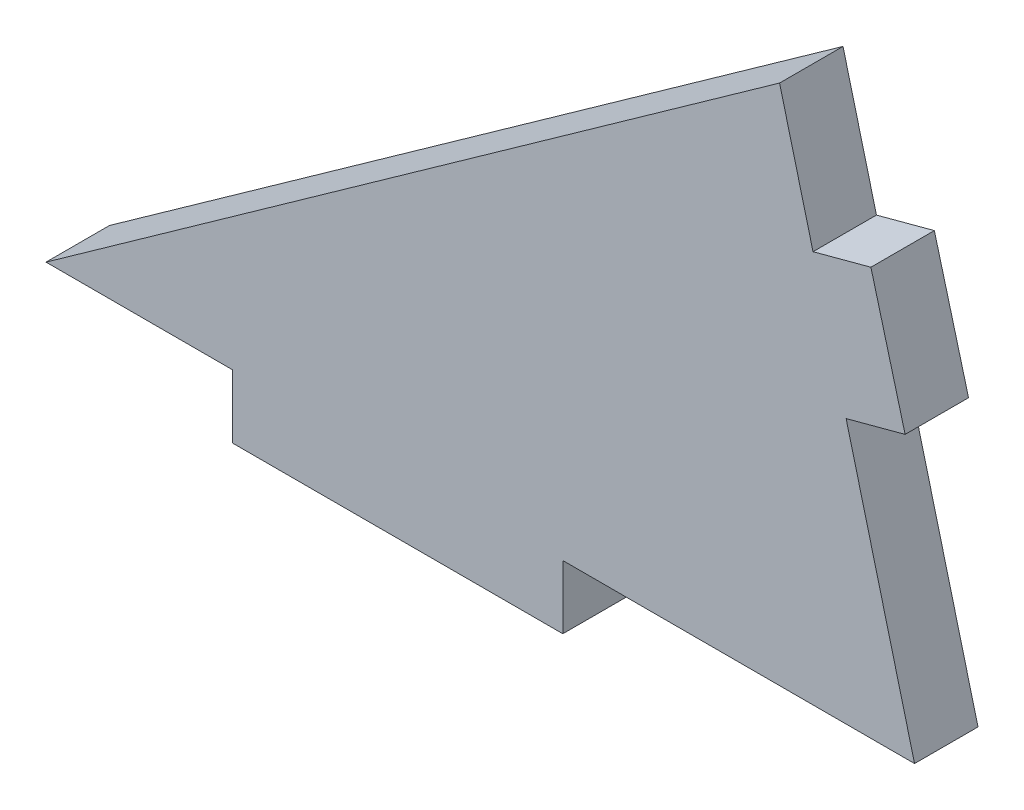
SolidWorks part; units mm, degrees
ref_plane "Front Plane" through (0, 0, 0) normal (0, 0, 1) x (1, 0, 0)
ref_plane "Top Plane" through (0, 0, 0) normal (0, 1, 0) x (1, 0, 0)
ref_plane "Right Plane" through (0, 0, 0) normal (1, 0, 0) x (0, 0, -1)
sketch "Sketch1" plane through (0, 0, 0) normal (0, 0, 1) x (1, 0, 0)
  line L0 (13.0177, -1.524) -> (20.9552, -1.524)
  line L1 (20.9552, -1.524) -> (20.9552, 0)
  line L2 (20.9552, 0) -> (29.4043, 0)
  line L3 (29.4043, 0) -> (27.7604, 6.3553)
  line L4 (13.0177, -1.524) -> (13.0177, 0)
  line L5 (13.0177, 0) -> (8.5404, 0)
  line L6 (26.9652, 9.4292) -> (26.1617, 12.5358)
  line L7 (27.7604, 6.3553) -> (29.1774, 6.735)
  line L8 (26.1617, 12.5358) -> (8.5404, 0)
  line L9 (26.9652, 9.4292) -> (28.3557, 9.8018)
  line L11 (29.1774, 6.735) -> (28.3557, 9.8018)
extrude "Boss-Extrude1" add sketch "Sketch1" along normal blind 1.524
